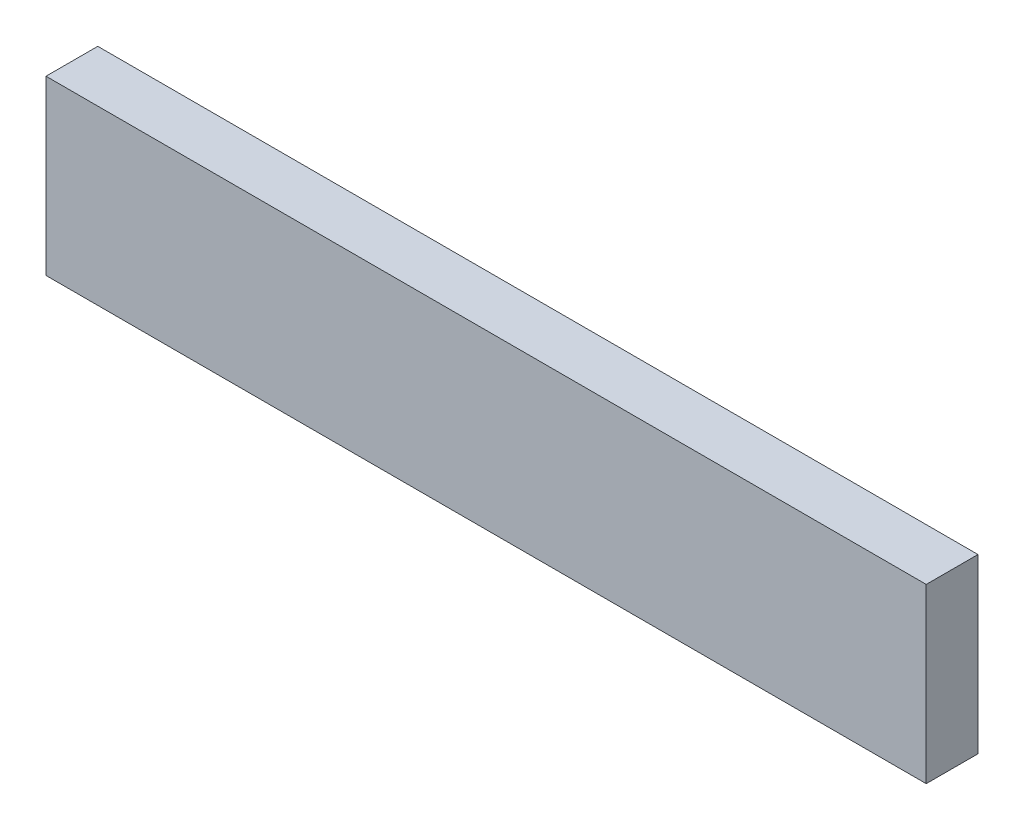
SolidWorks part; units mm, degrees
ref_plane "Front Plane" through (0, 0, 0) normal (0, 0, 1) x (1, 0, 0)
ref_plane "Top Plane" through (0, 0, 0) normal (0, 1, 0) x (1, 0, 0)
ref_plane "Right Plane" through (0, 0, 0) normal (1, 0, 0) x (0, 0, -1)
sketch "Sketch1" plane through (0, 0, 0) normal (0, 0, 1) x (1, 0, 0)
  line L0 (0, 27.6812) -> (-25.908, 27.6812)
  line L1 (-25.908, 27.6812) -> (-25.908, 22.6012)
  line L2 (-25.908, 22.6012) -> (0, 22.6012)
  line L3 (0, 22.6012) -> (0, 27.6812)
extrude "Boss-Extrude1" add sketch "Sketch1" along normal blind 1.524
